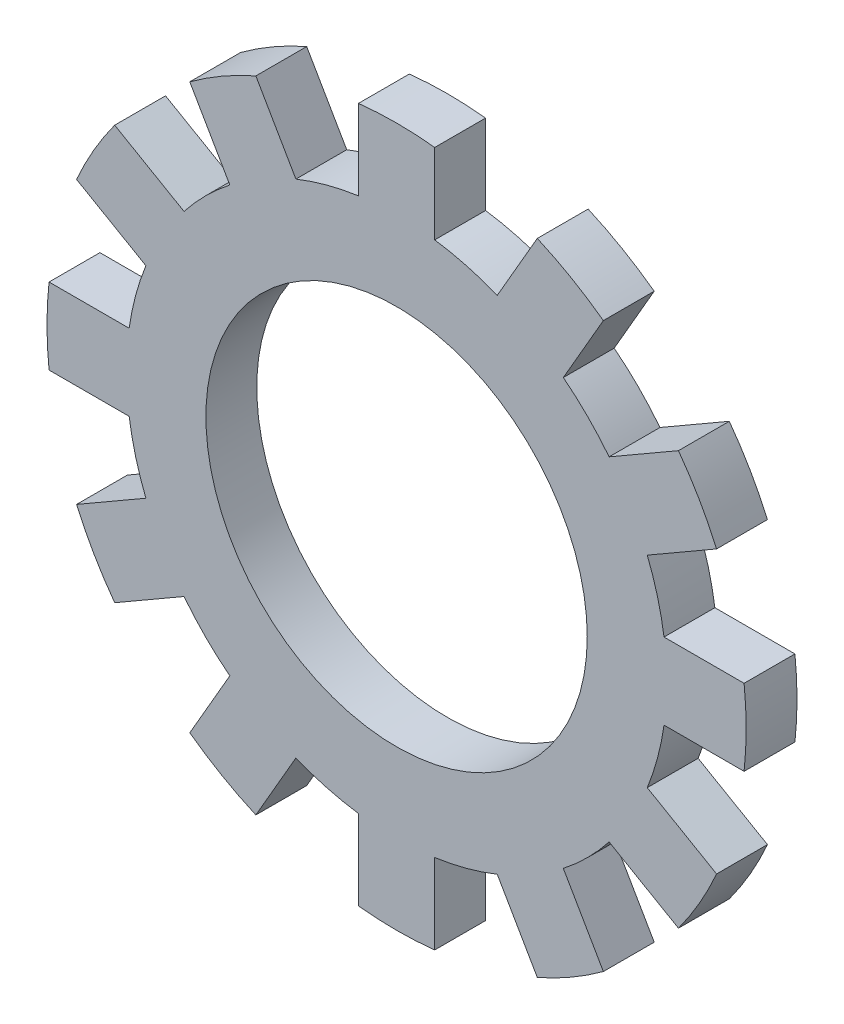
SolidWorks part; units mm, degrees
ref_plane "Front Plane" through (0, 0, 0) normal (0, 0, 1) x (1, 0, 0)
ref_plane "Top Plane" through (0, 0, 0) normal (0, 1, 0) x (1, 0, 0)
ref_plane "Right Plane" through (0, 0, 0) normal (1, 0, 0) x (0, 0, -1)
sketch "Sketch1" plane through (0, 0, 0) normal (0, 0, 1) x (1, 0, 0)
  circle A0 centre (0, 0) radius 1.5
  circle A1 centre (0, 0) radius 2.125
  dimension "D1" = 3
  dimension "D2" = 4.25
extrude "Boss-Extrude1" add sketch "Sketch1" along normal mid plane 0.4
sketch "Sketch2" plane through (0, 0, 0) normal (0, 0, 1) x (1, 0, 0)
  line L0 (0, 2.6811) -> (0, -2.8425) construction
sketch "Sketch3" plane through (0, 0, 0) normal (0, 0, 1) x (1, 0, 0)
  line L0 (-0.3, 2.7336) -> (-0.3, 2.1037)
  line L2 (0, 2.6811) -> (0, -2.8425) construction
  line L3 (0, 2.125) -> (0, 2.75)
  arc A0 (0, 2.75) -> (-0.3, 2.7336) centre (0, 0) ccw
  arc A1 (0, 2.125) -> (-0.3, 2.1037) centre (0, 0) ccw
  circle A2 centre (0, 0) radius 2.125 construction
  dimension "D2" = 2.75
  dimension "D1" = 0.3
extrude "Boss-Extrude2" add sketch "Sketch3" along normal mid plane 0.4
mirror "Mirror1" about plane through (0, 0, 0) normal (1, 0, 0) of "Boss-Extrude2"
pattern_circular "CirPattern2" count 12 over 360 about axis through (0, 0, 0) along (0, 0, 1) of "Boss-Extrude2", "Mirror1"
